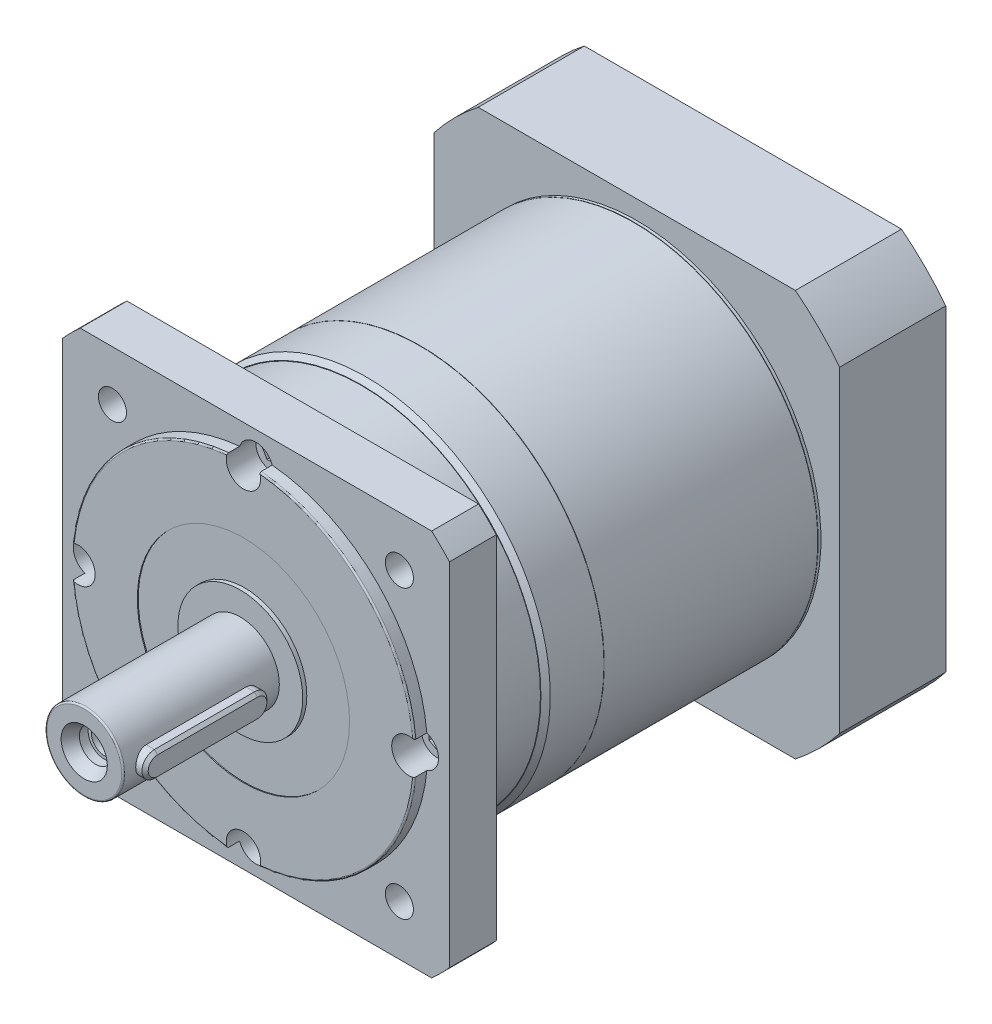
SolidWorks part; units mm, degrees
ref_plane "前视基准面" through (0, 0, 0) normal (0, 0, 1) x (1, 0, 0)
ref_plane "上视基准面" through (0, 0, 0) normal (0, 1, 0) x (1, 0, 0)
ref_plane "右视基准面" through (0, 0, 0) normal (1, 0, 0) x (0, 0, -1)
sketch "草图1" plane through (0, 0, 0) normal (0, 0, 1) x (1, 0, 0)
  circle A0 centre (0, 0) radius 59
extrude "凸台-拉伸1" add sketch "草图1" along normal blind 56.5
sketch "草图2" plane through (0, 0, 56.5) normal (0, 0, 1) x (1, 0, 0)
  circle A0 centre (0, 0) radius 55
extrude "切除-拉伸1" cut sketch "草图2" against normal blind 4 flip side to cut
ref_plane "基准面1" through (0, 0, -0.1) normal (0, 0, -1) x (-1, 0, 0)
sketch "草图4" plane through (0, 0, -0.1) normal (0, 0, -1) x (-1, 0, 0)
  circle A0 centre (0, 0) radius 59
extrude "凸台-拉伸2" add sketch "草图4" along normal blind 68.4 separate body
ref_plane "基准面2" through (0, 0, -68.6) normal (0, 0, -1) x (-1, 0, 0)
sketch "草图5" plane through (0, 0, -68.6) normal (0, 0, -1) x (-1, 0, 0)
  circle A0 centre (0, 0) radius 59
extrude "凸台-拉伸3" add sketch "草图5" along normal blind 0.9 separate body
sketch "草图6" plane through (0, 0, -69.5) normal (0, 0, -1) x (-1, 0, 0)
  line L1 (-50.806, 65) -> (50.806, 65)
  line L2 (-65, 50.806) -> (-65, -50.806)
  line L3 (-50.806, -65) -> (50.806, -65)
  line L4 (65, 50.806) -> (65, -50.806)
  arc A0 (-50.806, 65) -> (-65, 50.806) centre (0, 0) ccw
  arc A1 (-65, -50.806) -> (-50.806, -65) centre (0, 0) ccw
  arc A2 (50.806, -65) -> (65, -50.806) centre (0, 0) ccw
  arc A3 (65, 50.806) -> (50.806, 65) centre (0, 0) ccw
  dimension "D1" = 65
  dimension "D3" = 65
extrude "凸台-拉伸4" add sketch "草图6" along normal blind 34
sketch "草图7" plane through (0, 0, -103.5) normal (0, 0, -1) x (-1, 0, 0)
  circle A0 centre (0, 0) radius 55
extrude "切除-拉伸3" cut sketch "草图7" against normal blind 8
sketch "草图8" plane through (0, 0, -95.5) normal (0, 0, -1) x (-1, 0, 0)
  circle A0 centre (0, 0) radius 39
extrude "切除-拉伸4" cut sketch "草图8" against normal blind 30
sketch "草图9" plane through (0, 0, -103.5) normal (0, 0, -1) x (-1, 0, 0)
  line L0 (0, 0) -> (-53.5, 0) construction
  circle A0 centre (0, 0) radius 53.5 construction
  circle A1 centre (-53.5, 0) radius 5.5
extrude "切除-拉伸5" cut sketch "草图9" against normal blind 18
pattern_circular "阵列(圆周)1" count 6 over 360 about axis through (0, 0, 0) along (0, 0, 1) of "切除-拉伸5"
sketch "草图10" plane through (0, 0, -103.5) normal (0, 0, -1) x (-1, 0, 0)
  line L0 (0, 0) -> (-51.2652, 51.2652)
  circle A0 centre (0, 0) radius 72.5
hole_wizard "M8 螺纹孔1" positions "3D草图1" profile "草图11" tap size "M8" standard "GB"
sketch3d "3D草图1"
  point P0 (51.2652, 51.2652, -103.5)
sketch "草图11" plane through (51.2652, 51.2652, -103.5) normal (1, 0, 0) x (0, 1, 0)
  line L0 (0, 0) -> (0, 32.0429)
  line L1 (0, 32.0429) -> (3.4, 30)
  line L2 (3.4, 30) -> (3.4, 0)
  line L5 (3.4, 0) -> (0, 0)
  line L10 (0, 32.0429) -> (-3.4, 30) construction
  line L11 (0, -6.35) -> (0, 107.95) construction
  dimension "螺纹孔钻头直径" = 6.8
  dimension "螺纹孔钻头深度" = 30
  dimension "导头角度" = 118
pattern_circular "阵列(圆周)2" count 4 over 360 about axis through (0, 0, 0) along (0, 0, 1) of "M8 螺纹孔1"
fillet "圆角1" radius 0.5 1 edges at (55, 0, 56.5)
sketch "草图12" plane through (0, 0, 56.5) normal (0, 0, 1) x (1, 0, 0)
  circle A0 centre (0, 0) radius 20
extrude "凸台-拉伸5" add sketch "草图12" along normal blind 1
sketch "草图13" plane through (0, 0, 57.5) normal (0, 0, 1) x (1, 0, 0)
  circle A0 centre (0, 0) radius 12.5
extrude "凸台-拉伸6" add sketch "草图13" along normal blind 50
fillet "圆角2" radius 0.5 1 edges at (12.5, 0, 107.5)
sketch "草图14" plane through (0, 0, 52.5) normal (0, 0, 1) x (1, 0, 0)
  line L0 (0, 0) -> (0, -53) construction
  circle A0 centre (0, 0) radius 53 construction
  circle A1 centre (0, -53) radius 5.5
extrude "切除-拉伸6" cut sketch "草图14" against normal blind 11
pattern_circular "阵列(圆周)3" count 4 over 360 about axis through (0, 0, 0) along (0, 0, 1) of "切除-拉伸6"
sketch "草图15" plane through (0, 0, 41.5) normal (0, 0, 1) x (1, 0, 0)
  line L1 (1.4595, -50.5094) -> (-1.4271, -50.4907)
  line L2 (-1.4271, -50.4907) -> (-2.8867, -52.9813)
  line L3 (-2.8867, -52.9813) -> (-1.4595, -55.4906)
  line L4 (-1.4595, -55.4906) -> (1.4271, -55.5093)
  line L5 (1.4271, -55.5093) -> (2.8867, -53.0187)
  line L6 (2.8867, -53.0187) -> (1.4595, -50.5094)
  circle A0 centre (0, -53) radius 5
  circle A1 centre (0, -53) radius 2.5 construction
  dimension "D1" = 5
extrude "凸台-拉伸7" add sketch "草图15" along normal blind 6
pattern_circular "阵列(圆周)4" count 4 over 360 about axis through (0, 0, 0) along (0, 0, 1) of "凸台-拉伸7"
sketch "草图16" plane through (0, 0, -85.5) normal (0, 0, -1) x (-1, 0, 0)
  line L1 (-51.8653, 2.3793) -> (-54.7432, 2.6053)
  line L2 (-54.7432, 2.6053) -> (-56.3779, 0.226)
  line L3 (-56.3779, 0.226) -> (-55.1347, -2.3793)
  line L4 (-55.1347, -2.3793) -> (-52.2568, -2.6053)
  line L5 (-52.2568, -2.6053) -> (-50.6221, -0.226)
  line L6 (-50.6221, -0.226) -> (-51.8653, 2.3793)
  circle A0 centre (-53.5, 0) radius 5
  circle A1 centre (-53.5, 0) radius 2.5 construction
  dimension "D1" = 5
extrude "凸台-拉伸8" add sketch "草图16" along normal blind 6
pattern_circular "阵列(圆周)5" count 6 over 360 about axis through (0, 0, 0) along (0, 0, 1) of "凸台-拉伸8"
ref_plane "基准面3" through (0, 0, -88.5) normal (0, 0, -1) x (-1, 0, 0)
sketch "草图17" plane through (0, 0, -88.5) normal (0, 0, -1) x (-1, 0, 0)
  circle A0 centre (0, 0) radius 32.5
extrude "凸台-拉伸9" add sketch "草图17" against normal up to surface (23 mm away)
chamfer "倒角2" distance 1 angle 45 1 edges at (-32.5, 0, -88.5)
sketch "草图18" plane through (0, 0, -88.5) normal (0, 0, -1) x (-1, 0, 0)
  line L1 (-35.6857, 0.5) -> (35.4718, 0.5)
  line L2 (-35.6857, 0.5) -> (-35.6857, -0.5)
  line L3 (-35.6857, -0.5) -> (35.4718, -0.5)
  line L4 (35.4718, 0.5) -> (35.4718, -0.5)
  dimension "D1" = 0.5
  dimension "D2" = 1
extrude "切除-拉伸7" cut sketch "草图18" against normal up to surface (23 mm away)
sketch "草图19" plane through (0, 0, -103.5) normal (0, 0, -1) x (-1, 0, 0)
  circle A0 centre (0, 0) radius 11
extrude "切除-拉伸8" cut sketch "草图19" against normal blind 59
sketch "草图20" plane through (0, 0, 52.5) normal (0, 0, 1) x (1, 0, 0)
  line L0 (0, 0) -> (-35.3553, 35.3553)
  line L1 (0, 0) -> (0, 53)
  circle A0 centre (0, 0) radius 50
  dimension "D1" = 45
sketch "草图22" plane through (0, 0, 0) normal (1, 0, 0) x (0, 0, -1)
  line L0 (-107.5, 12) -> (-107.5, -12) construction
  line L1 (-99.5, 4) -> (-67.5, 4)
  line L2 (-99.5, -4) -> (-67.5, -4)
  arc A0 (-99.5, 4) -> (-99.5, -4) centre (-99.5, 0) ccw
  arc A1 (-67.5, -4) -> (-67.5, 4) centre (-67.5, 0) ccw
  dimension "D1" = 8
  dimension "D2" = 32
extrude "凸台-拉伸10" add sketch "草图22" along normal blind 15.5
chamfer "倒角3" distance 1 angle 45 4 edges at (15.5, 4, 83.5) (15.5, 0, 103.5) (15.5, 0, 63.5) (15.5, -4, 83.5)
sketch "草图23" plane through (0, 0, 52.5) normal (0, 0, 1) x (1, 0, 0)
  line L1 (-56.3033, 62) -> (56.3033, 62)
  line L2 (-62, 56.3033) -> (-62, -56.3033)
  line L3 (-56.3033, -62) -> (56.3033, -62)
  line L4 (62, 56.3033) -> (62, -56.3033)
  circle A0 centre (0, 0) radius 59
  arc A1 (-56.3033, 62) -> (-62, 56.3033) centre (0, 0) ccw
  arc A2 (-62, -56.3033) -> (-56.3033, -62) centre (0, 0) ccw
  arc A3 (56.3033, -62) -> (62, -56.3033) centre (0, 0) ccw
  arc A4 (62, 56.3033) -> (56.3033, 62) centre (0, 0) ccw
  dimension "D2" = 118
  dimension "D1" = 62
  dimension "D3" = 62
extrude "凸台-拉伸11" add sketch "草图23" against normal blind 15
sketch "草图24" plane through (0, 0, 37.5) normal (0, 0, -1) x (-1, 0, 0)
  circle A0 centre (0, 0) radius 57.35
extrude "切除-拉伸9" cut sketch "草图24" along normal blind 18.8 flip side to cut
chamfer "倒角4" distance 1.5 angle 45 1 edges at (-59, 0, 18.7)
sketch "草图25" plane through (0, 0, 52.5) normal (0, 0, 1) x (1, 0, 0)
  line L0 (0, 0) -> (-59.2202, 59.2202) construction
  circle A0 centre (0, 0) radius 65 construction
  arc A1 (-56.3033, 62) -> (-62, 56.3033) centre (0, 0) ccw construction
  circle A2 centre (-45.9619, 45.9619) radius 4.5
extrude "切除-拉伸10" cut sketch "草图25" against normal blind 18.8
pattern_circular "阵列(圆周)6" count 4 over 360 about axis through (0, 0, 0) along (0, 0, 1) of "切除-拉伸10"
sketch "草图27" plane through (0, 0, 56.5) normal (0, 0, 1) x (1, 0, 0)
  circle A0 centre (-53, 0) radius 5.5
extrude "切除-拉伸11" cut sketch "草图27" against normal up to surface (4 mm away)
pattern_circular "阵列(圆周)7" count 4 over 360 about axis through (0, 0, 52.5) along (0, 0, 1) of "切除-拉伸11"
sketch "草图28" plane through (0, 0, 56.5) normal (0, 0, 1) x (1, 0, 0)
  circle A0 centre (0, 0) radius 34
  circle A1 centre (0, 0) radius 20
extrude "切除-拉伸12" cut sketch "草图28" against normal blind 0.3
sketch "草图29" plane through (0, 0, 107.5) normal (0, 0, 1) x (1, 0, 0)
  circle A0 centre (0, 0) radius 5.25
extrude "切除-拉伸13" cut sketch "草图29" against normal blind 6.5
sketch "草图30" plane through (0, 0, 107.5) normal (0, 0, 1) x (1, 0, 0)
  circle A0 centre (0, 0) radius 7.4
ref_plane "基准面4" through (0, 0, 103.8) normal (0, 0, 1) x (1, 0, 0)
sketch "草图31" plane through (0, 0, 103.8) normal (0, 0, 1) x (1, 0, 0)
  circle A0 centre (0, 0) radius 5.25 construction
  circle A1 centre (0, 0) radius 5.25
loft "切除-放样1" cut profiles "草图30", "草图31"
hole_wizard "M10 螺纹孔1" positions "3D草图2" profile "草图32" tap size "M10" standard "GB"
sketch3d "3D草图2"
  line L0 (0, 0, 101) -> (0, 0, 103.8) construction
  point P0 (0, 0, 101)
sketch "草图32" plane through (0, 0, 101) normal (1, 0, 0) x (0, -1, 0)
  line L0 (0, 0) -> (0, 26.5537)
  line L1 (0, 26.5537) -> (4.25, 24)
  line L2 (4.25, 24) -> (4.25, 0)
  line L5 (4.25, 0) -> (0, 0)
  line L10 (0, 26.5537) -> (-4.25, 24) construction
  line L11 (0, -6.35) -> (0, 107.95) construction
  dimension "螺纹孔钻头直径" = 8.5
  dimension "螺纹孔钻头深度" = 24
  dimension "导头角度" = 118
